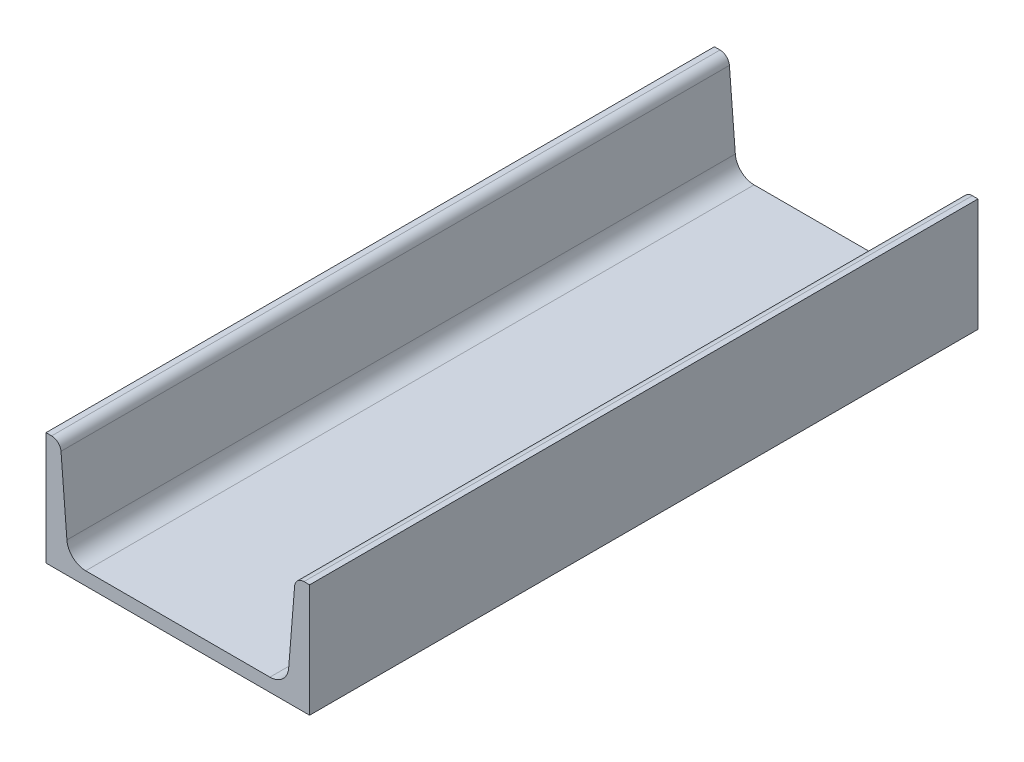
SolidWorks part; units mm, degrees
ref_plane "Plan de face" through (0, 0, 0) normal (0, 0, 1) x (1, 0, 0)
ref_plane "Plan de dessus" through (0, 0, 0) normal (0, 1, 0) x (1, 0, 0)
ref_plane "Plan de droite" through (0, 0, 0) normal (1, 0, 0) x (0, 0, -1)
ref_plane "Plan1" through (0, 0, 177.5) normal (0, 0, 1) x (1, 0, 0)
sketch "Esquisse1" plane through (0, 0, 177.5) normal (0, 0, 1) x (1, 0, 0)
  line L0 (48.9281, 7) -> (-48.9281, 7)
  line L1 (-58.8962, 16.2025) -> (-62.0319, 55.3987)
  line L2 (-67.016, 60) -> (-70, 60)
  line L3 (-70, 60) -> (-70, 0)
  line L4 (-70, 0) -> (70, 0)
  line L5 (70, 0) -> (70, 60)
  line L6 (70, 60) -> (67.016, 60)
  line L7 (62.0319, 55.3987) -> (58.8962, 16.2025)
  arc A0 (58.8962, 16.2025) -> (48.9281, 7) centre (48.9281, 17) cw
  arc A1 (-48.9281, 7) -> (-58.8962, 16.2025) centre (-48.9281, 17) cw
  arc A2 (-62.0319, 55.3987) -> (-67.016, 60) centre (-67.016, 55) ccw
  arc A3 (67.016, 60) -> (62.0319, 55.3987) centre (67.016, 55) ccw
extrude "Boss.-Extru.1" add sketch "Esquisse1" against normal up to body (355 mm away) separate body
